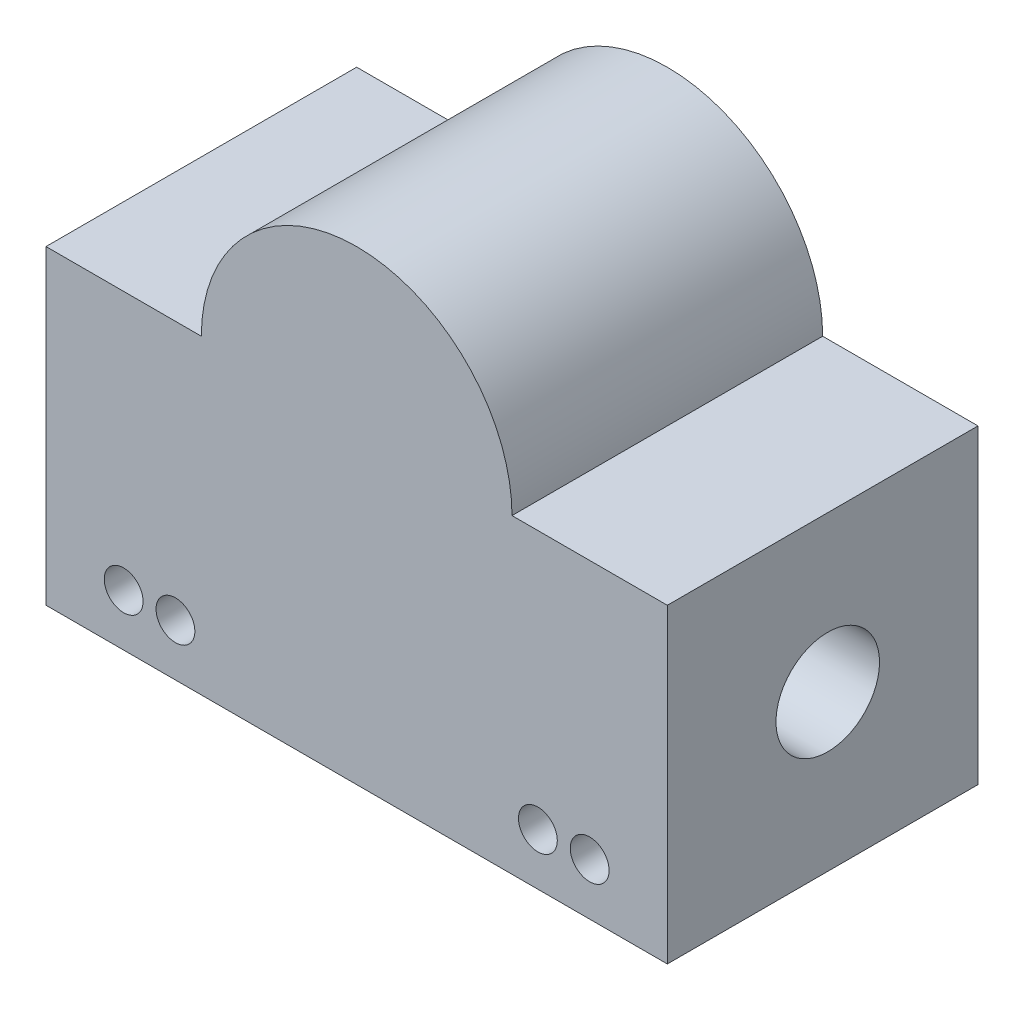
SolidWorks part; units mm, degrees
ref_plane "Front Plane" through (0, 0, 0) normal (0, 0, 1) x (1, 0, 0)
ref_plane "Top Plane" through (0, 0, 0) normal (0, 1, 0) x (1, 0, 0)
ref_plane "Right Plane" through (0, 0, 0) normal (1, 0, 0) x (0, 0, -1)
sketch "Sketch1" plane through (0, 0, 0) normal (0, 0, 1) x (1, 0, 0)
  line L0 (57.15, 38.1) -> (76.2, 38.1)
  line L1 (0, 0) -> (76.2, 0)
  line L2 (0, 0) -> (0, 38.1)
  line L3 (0, 38.1) -> (19.05, 38.1)
  line L4 (76.2, 0) -> (76.2, 38.1)
  arc A0 (57.15, 38.1) -> (19.05, 38.1) centre (38.1, 38.1) ccw
  dimension "D1" = 38.1
  dimension "D3" = 38.1
  dimension "D2" = 76.2
  dimension "D4" = 38.1
extrude "Boss-Extrude1" add sketch "Sketch1" along normal blind 38.1 contours L3 A0 L0 L4 L1 L2
sketch "Sketch2" plane through (76.2, 0, 0) normal (1, 0, 0) x (0, 0, -1)
  line L0 (-38.1, 0) -> (0, 0) construction
  line L1 (-38.1, 0) -> (-38.1, 38.1) construction
  circle A0 centre (-18.4273, 19.05) radius 6.35
  dimension "D1" = 12.7
  dimension "D2" = 19.05
  dimension "D3" = 19.6727
extrude "Cut-Extrude1" cut sketch "Sketch2" against normal through all
sketch "Sketch3" plane through (0, 0, 38.1) normal (0, 0, 1) x (1, 0, 0)
  line L0 (38.1, 0) -> (38.1, 57.15) construction
  line L1 (0, 0) -> (76.2, 0) construction
  circle A0 centre (9.525, 6.35) radius 2.3813
  circle A1 centre (15.875, 6.35) radius 2.3813
  circle A2 centre (60.325, 6.35) radius 2.3813
  circle A3 centre (66.675, 6.35) radius 2.3813
  arc A4 (57.15, 38.1) -> (19.05, 38.1) centre (38.1, 38.1) ccw construction
  dimension "D1" = 4.7625
  dimension "D2" = 57.15
  dimension "D3" = 44.45
  dimension "D4" = 22.225
  dimension "D5" = 28.575
  dimension "D6" = 6.35
extrude "Cut-Extrude2" cut sketch "Sketch3" against normal through all contours A0 | A1 | A2 | A3
ref_plane "Plane1" through (0, 19.05, 0) normal (0, 1, 0) x (1, 0, 0)
sketch "Sketch4" plane through (0, 19.05, 0) normal (0, 1, 0) x (1, 0, 0)
  line L0 (-5.0887, -19.05) -> (81.2887, -19.05) construction
  line L1 (38.1, 12.1039) -> (38.1, -50.2039) construction
  line L2 (57.15, 0) -> (19.05, 0) construction
  line L3 (76.2, -38.1) -> (76.2, 0) construction
  point P4 (38.1, -19.05)
  point P5 (38.1, -19.05)
  dimension "D1" = 19.05
  dimension "D2" = 38.1
